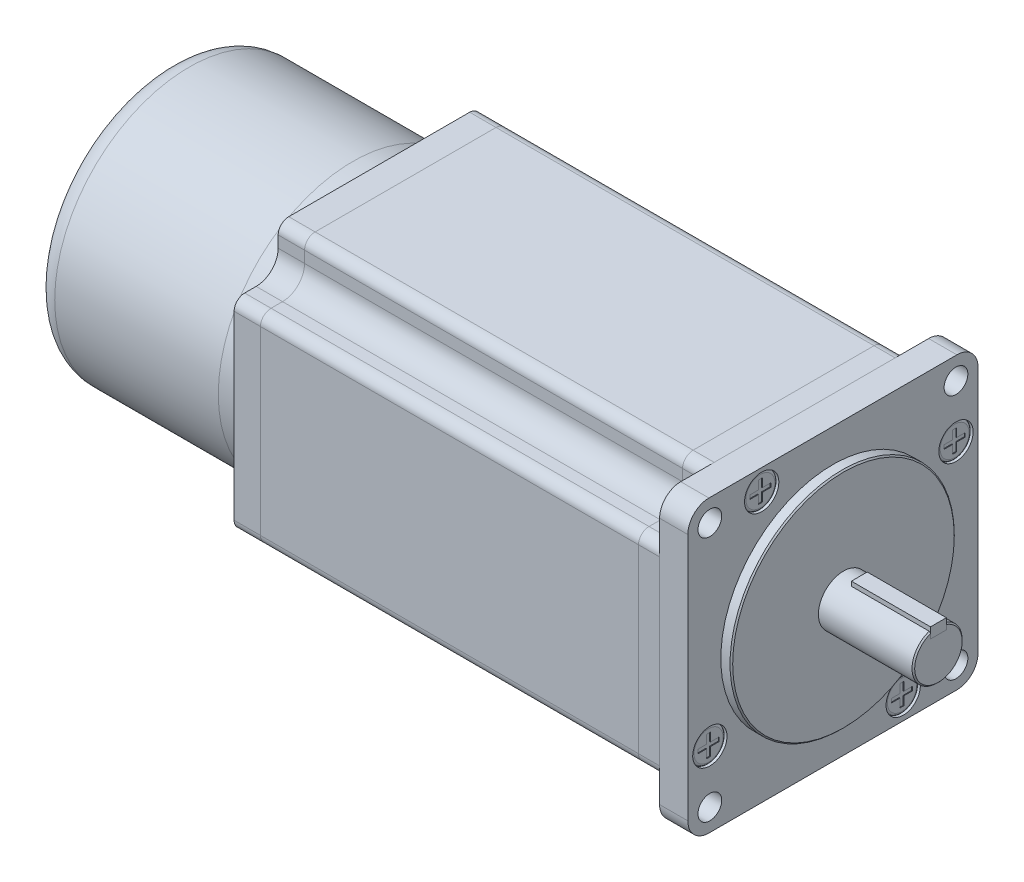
SolidWorks part; units mm, degrees
ref_plane "前视基准面" through (0, 0, 0) normal (0, 0, 1) x (1, 0, 0)
ref_plane "上视基准面" through (0, 0, 0) normal (0, 1, 0) x (1, 0, 0)
ref_plane "右视基准面" through (0, 0, 0) normal (1, 0, 0) x (0, 0, -1)
sketch "草图1" plane through (0, 0, 0) normal (1, 0, 0) x (0, 0, -1)
  line L1 (-47, -55) -> (47, -55)
  line L2 (-55, -47) -> (-55, 47)
  line L3 (-47, 55) -> (47, 55)
  line L4 (55, -47) -> (55, 47)
  line L5 (-55, -55) -> (55, 55) construction
  line L6 (-55, 55) -> (55, -55) construction
  arc A0 (-55, -47) -> (-47, -55) centre (-47, -47) ccw
  arc A1 (47, -55) -> (55, -47) centre (47, -47) ccw
  arc A2 (55, 47) -> (47, 55) centre (47, 47) ccw
  arc A3 (-55, 47) -> (-47, 55) centre (-47, 47) cw
  point P0 (0, 0)
  dimension "D1" = 8
extrude "凸台-拉伸1" add sketch "草图1" against normal blind 10.7
sketch "草图2" plane through (-10.7, 0, 0) normal (-1, 0, 0) x (0, 0, 1)
  line L0 (-55, -47) -> (-55, 47) construction
  line L1 (47, -55) -> (-47, -55)
  line L2 (55, -47) -> (55, 47)
  line L3 (47, 55) -> (-47, 55)
  line L4 (-55, -47) -> (-55, 47)
  line L5 (55, -55) -> (-55, 55) construction
  line L6 (55, 55) -> (-55, -55) construction
  arc A0 (47, -55) -> (55, -47) centre (47, -47) ccw
  arc A1 (55, 47) -> (47, 55) centre (47, 47) ccw
  arc A2 (-47, 55) -> (-55, 47) centre (-47, 47) ccw
  arc A3 (-47, -55) -> (-55, -47) centre (-47, -47) cw
  point P0 (0, 0)
  dimension "D1" = 8
extrude "凸台-拉伸2" add sketch "草图2" along normal blind 8 separate body
sketch "草图3" plane through (-18.7, 0, 0) normal (-1, 0, 0) x (0, 0, 1)
  line L0 (-55, 47) -> (-55, -47) construction
  line L1 (47, -55) -> (-47, -55)
  line L2 (55, -47) -> (55, 47)
  line L3 (47, 55) -> (-47, 55)
  line L4 (-55, -47) -> (-55, 47)
  line L5 (55, -55) -> (-55, 55) construction
  line L6 (55, 55) -> (-55, -55) construction
  arc A0 (47, -55) -> (55, -47) centre (47, -47) ccw
  arc A1 (55, 47) -> (47, 55) centre (47, 47) ccw
  arc A2 (-47, 55) -> (-55, 47) centre (-47, 47) ccw
  arc A3 (-47, -55) -> (-55, -47) centre (-47, -47) cw
  point P0 (0, 0)
  dimension "D1" = 8
extrude "凸台-拉伸3" add sketch "草图3" along normal blind 143.3 separate body
sketch "草图4" plane through (-162, 0, 0) normal (-1, 0, 0) x (0, 0, 1)
  line L0 (-46.65, -38.3) -> (-51, -38.3)
  line L1 (46.65, -38.3) -> (51, -38.3)
  line L2 (-47, -55) -> (-34.3, -55)
  line L3 (38.3, -46.65) -> (38.3, -51)
  line L5 (-55, -47) -> (-55, -34.3)
  line L6 (-55, 34.2927) -> (-55, 47)
  line L9 (-38.3, -46.65) -> (-38.3, -51)
  line L11 (-47, 55) -> (-34.2927, 55)
  line L12 (34.2927, 55) -> (47, 55)
  line L14 (55, 47) -> (55, 34.2927)
  line L15 (55, -34.3) -> (55, -47)
  line L17 (46.65, 38.2927) -> (51, 38.2927)
  line L19 (47, -55) -> (34.3, -55)
  line L20 (38.2927, 46.65) -> (38.2927, 51)
  line L23 (-38.2927, 46.65) -> (-38.2927, 51)
  line L25 (-46.65, 38.2927) -> (-51, 38.2927)
  arc A0 (-38.3, -46.65) -> (-46.65, -38.3) centre (-46.65, -46.65) ccw
  arc A1 (-46.65, 38.2927) -> (-38.2927, 46.65) centre (-46.65, 46.65) ccw
  arc A2 (38.2927, 46.65) -> (46.65, 38.2927) centre (46.65, 46.65) ccw
  arc A3 (46.65, -38.3) -> (38.3, -46.65) centre (46.65, -46.65) ccw
  arc A4 (-55, -47) -> (-47, -55) centre (-47, -47) ccw
  arc A5 (-47, 55) -> (-55, 47) centre (-47, 47) ccw
  arc A6 (55, 47) -> (47, 55) centre (47, 47) ccw
  arc A7 (47, -55) -> (55, -47) centre (47, -47) ccw
  arc A8 (38.3, -51) -> (34.3, -55) centre (34.3, -51) cw
  arc A9 (51, -38.3) -> (55, -34.3) centre (51, -34.3) ccw
  arc A10 (55, 34.2927) -> (51, 38.2927) centre (51, 34.2927) ccw
  arc A11 (38.2927, 51) -> (34.2927, 55) centre (34.2927, 51) ccw
  arc A12 (-34.2927, 55) -> (-38.2927, 51) centre (-34.2927, 51) ccw
  arc A13 (-51, 38.2927) -> (-55, 34.2927) centre (-51, 34.2927) ccw
  arc A14 (-51, -38.3) -> (-55, -34.3) centre (-51, -34.3) cw
  arc A15 (-34.3, -55) -> (-38.3, -51) centre (-34.3, -51) cw
  point P0 (0, 0)
  dimension "D1" = 4
  dimension "D2" = 4
extrude "切除-拉伸1" cut sketch "草图4" against normal blind 161.3
sketch "草图6" plane through (0, 0, 0) normal (1, 0, 0) x (0, 0, -1)
  circle A0 centre (0, 0) radius 42.5
extrude "凸台-拉伸5" add sketch "草图6" along normal blind 4
chamfer "倒角1" distance 0.5 angle 45 1 edges at (4, 0, -42.5)
sketch "草图7" plane through (4, 0, 0) normal (1, 0, 0) x (0, 0, -1)
  circle A0 centre (0, 0) radius 9.5
extrude "凸台-拉伸6" add sketch "草图7" along normal blind 36
chamfer "倒角2" distance 0.5 angle 45 1 edges at (40, 0, -9.5)
sketch "草图8" plane through (40, 0, 0) normal (1, 0, 0) x (0, 0, -1)
  line L3 (-3, 6.7) -> (-3, 9.0139)
  line L5 (3, 9.0139) -> (3, 6.7)
  line L6 (-3, 6.7) -> (3, 6.7)
  arc A0 (3, 9.0139) -> (-3, 9.0139) centre (0, 0) ccw
sketch "草图10" plane through (0, 0, 0) normal (1, 0, 0) x (0, 0, -1)
  line L1 (-46.65, -46.65) -> (46.65, -46.65)
  line L2 (-46.65, -46.65) -> (-46.65, 46.65)
  line L3 (-46.65, 46.65) -> (46.65, 46.65)
  line L4 (46.65, -46.65) -> (46.65, 46.65)
  line L5 (-46.65, -46.65) -> (46.65, 46.65) construction
  line L6 (-46.65, 46.65) -> (46.65, -46.65) construction
  circle A0 centre (46.65, 46.65) radius 4.5
  circle A1 centre (46.65, -46.65) radius 4.5
  circle A2 centre (-46.65, -46.65) radius 4.5
  circle A3 centre (-46.65, 46.65) radius 4.5
  point P0 (0, 0)
extrude "切除-拉伸3" cut sketch "草图10" against normal blind 10.7 contours L3 A3 L2 | L2 A3 L3 | L4 A0 L3 | L3 A0 L4 | L1 A1 L4 | L4 A1 L1 | L2 A2 L1 | L1 A2 L2
sketch "草图11" plane through (0, 0, 0) normal (1, 0, 0) x (0, 0, -1)
  circle A0 centre (-27, 47) radius 6.5
  circle A1 centre (46.65, 26.65) radius 6.5
  circle A2 centre (26.65, -46.65) radius 6.5
  circle A3 centre (-46.65, -26.65) radius 6.5
extrude "切除-拉伸4" cut sketch "草图11" against normal blind 1.5
sketch "草图12" plane through (-1.5, 0, 0) normal (1, 0, 0) x (0, 0, -1)
  circle A0 centre (-27, 47) radius 6.5
  circle A1 centre (46.65, 26.65) radius 6.5
  circle A2 centre (26.65, -46.65) radius 6.5
  circle A3 centre (-46.65, -26.65) radius 6.5
extrude "凸台-拉伸8" add sketch "草图12" along normal blind 1 separate body
fillet "圆角2" radius 1 1 edges at (-0.5, 47, 20.5)
fillet "圆角3" radius 1 1 edges at (-0.5, 26.65, -53.15)
fillet "圆角4" radius 1 1 edges at (-0.5, -26.65, 40.15)
fillet "圆角5" radius 1 1 edges at (-0.5, -46.65, -33.15)
sketch "草图13" plane through (-0.5, 0, 0) normal (1, 0, 0) x (0, 0, -1)
  line L0 (45.9, 25.9) -> (45.9, 22.65)
  line L1 (-27.75, 51) -> (-26.25, 51)
  line L2 (-27.75, 51) -> (-27.75, 47.75)
  line L3 (-27.75, 43) -> (-26.25, 43)
  line L4 (-26.25, 51) -> (-26.25, 47.75)
  line L5 (-47.4, -27.4) -> (-47.4, -30.65)
  line L6 (-47.4, -27.4) -> (-50.65, -27.4)
  line L7 (-23, 47.75) -> (-26.25, 47.75)
  line L8 (-23, 47.75) -> (-23, 46.25)
  line L9 (-23, 46.25) -> (-26.25, 46.25)
  line L10 (-31, 47.75) -> (-31, 46.25)
  line L11 (25.9, -45.9) -> (22.65, -45.9)
  line L12 (-47.4, -25.9) -> (-50.65, -25.9)
  line L13 (45.9, 30.65) -> (47.4, 30.65)
  line L14 (45.9, 30.65) -> (45.9, 27.4)
  line L15 (45.9, 22.65) -> (47.4, 22.65)
  line L16 (47.4, 30.65) -> (47.4, 27.4)
  line L17 (-27.75, 46.25) -> (-27.75, 43)
  line L18 (-45.9, -27.4) -> (-45.9, -30.65)
  line L19 (50.65, 27.4) -> (47.4, 27.4)
  line L20 (50.65, 27.4) -> (50.65, 25.9)
  line L21 (50.65, 25.9) -> (47.4, 25.9)
  line L22 (42.65, 27.4) -> (42.65, 25.9)
  line L25 (25.9, -42.65) -> (27.4, -42.65)
  line L26 (25.9, -42.65) -> (25.9, -45.9)
  line L27 (25.9, -50.65) -> (27.4, -50.65)
  line L28 (27.4, -42.65) -> (27.4, -45.9)
  line L31 (30.65, -45.9) -> (27.4, -45.9)
  line L32 (30.65, -45.9) -> (30.65, -47.4)
  line L33 (30.65, -47.4) -> (27.4, -47.4)
  line L34 (22.65, -45.9) -> (22.65, -47.4)
  line L37 (-47.4, -22.65) -> (-45.9, -22.65)
  line L38 (-47.4, -22.65) -> (-47.4, -25.9)
  line L39 (-47.4, -30.65) -> (-45.9, -30.65)
  line L40 (-45.9, -22.65) -> (-45.9, -25.9)
  line L41 (27.4, -47.4) -> (27.4, -50.65)
  line L43 (-42.65, -25.9) -> (-45.9, -25.9)
  line L44 (-42.65, -25.9) -> (-42.65, -27.4)
  line L45 (-42.65, -27.4) -> (-45.9, -27.4)
  line L46 (-50.65, -25.9) -> (-50.65, -27.4)
  line L48 (25.9, -47.4) -> (22.65, -47.4)
  line L49 (25.9, -47.4) -> (25.9, -50.65)
  line L50 (-27.75, 46.25) -> (-31, 46.25)
  line L51 (-26.25, 46.25) -> (-26.25, 43)
  line L52 (-27.75, 47.75) -> (-31, 47.75)
  line L53 (45.9, 25.9) -> (42.65, 25.9)
  line L54 (47.4, 25.9) -> (47.4, 22.65)
  line L55 (45.9, 27.4) -> (42.65, 27.4)
  point P0 (-27, 47)
  point P6 (-27, 47)
  point P11 (46.65, 26.65)
  point P17 (46.65, 26.65)
  point P22 (26.65, -46.65)
  point P28 (26.65, -46.65)
  point P33 (-46.65, -26.65)
  point P39 (-46.65, -26.65)
extrude "切除-拉伸5" cut sketch "草图13" against normal blind 0.3
sketch "草图14" plane through (-162, 0, 0) normal (-1, 0, 0) x (0, 0, 1)
  line L0 (-51, -38.3) -> (-46.3, -38.3073)
  line L1 (-34.3, -55) -> (34.3, -55)
  line L4 (55, -34.3) -> (55, 34.2927)
  line L6 (-55, -34.3) -> (-55, 34.2927)
  line L7 (-38.3, -46.65) -> (-38.3, -51)
  line L8 (-34.3, -55) -> (34.3, -55)
  line L10 (38.3, -51) -> (38.3, -46.65)
  line L12 (46.65, -38.3) -> (51, -38.3)
  line L14 (55, -34.3) -> (55, 34.2927)
  line L16 (51, 38.2927) -> (46.65, 38.2927)
  line L18 (38.2927, 46.65) -> (38.2927, 51)
  line L19 (34.2927, 55) -> (-34.2927, 55)
  line L21 (-38.2927, 51) -> (-38.2927, 46.65)
  line L23 (-46.65, 38.2927) -> (-51, 38.2927)
  line L25 (-34.2927, 55) -> (34.2927, 55)
  line L27 (55, 46.3) -> (55, 47)
  arc A0 (-38.3, -46.65) -> (-46.9739, -38.3063) centre (-46.65, -46.65) ccw
  arc A2 (38.2927, 46.65) -> (46.65, 38.2927) centre (46.65, 46.65) ccw
  arc A3 (46.65, -38.3) -> (38.3, -46.65) centre (46.65, -46.65) ccw
  arc A4 (34.3, -55) -> (38.3, -51) centre (34.3, -51) ccw
  arc A5 (51, -38.3) -> (55, -34.3) centre (51, -34.3) ccw
  arc A6 (55, 34.2927) -> (51, 38.2927) centre (51, 34.2927) ccw
  arc A7 (38.2927, 51) -> (34.2927, 55) centre (34.2927, 51) ccw
  arc A8 (-34.2927, 55) -> (-38.2927, 51) centre (-34.2927, 51) ccw
  arc A9 (-51, 38.2927) -> (-55, 34.2927) centre (-51, 34.2927) ccw
  arc A10 (-55, -34.3) -> (-51, -38.3) centre (-51, -34.3) ccw
  arc A11 (-38.3, -51) -> (-34.3, -55) centre (-34.3, -51) ccw
  arc A12 (38.2927, 51) -> (34.2927, 55) centre (34.2927, 51) ccw
  arc A13 (-46.65, 38.2927) -> (-38.2927, 46.65) centre (-46.65, 46.65) ccw
  arc A16 (55, 46.3) -> (55, 47) centre (46.65, 46.65) ccw
  point P0 (0, 0)
extrude "凸台-拉伸10" add sketch "草图14" along normal blind 10 separate body
sketch "草图15" plane through (-172, 0, 0) normal (-1, 0, 0) x (0, 0, 1)
  circle A0 centre (0, 0) radius 51
extrude "凸台-拉伸11" add sketch "草图15" along normal blind 10
extrude "切除-拉伸6" cut sketch "草图8" against normal blind 30
sketch "草图16" plane through (0, 6.7, 0) normal (0, 1, 0) x (1, 0, 0)
  line L0 (40, -3) -> (40, 3)
  line L1 (40, 3) -> (10, 3)
  line L2 (10, 3) -> (10, -3)
  line L3 (10, -3) -> (40, -3)
extrude "凸台-拉伸12" add sketch "草图16" along normal blind 4 separate body
sketch "草图17" plane through (-182, 0, 0) normal (-1, 0, 0) x (0, 0, 1)
  circle A0 centre (0, 0) radius 51
extrude "凸台-拉伸13" add sketch "草图17" along normal blind 70 separate body
fillet "圆角6" radius 8 1 edges at (-252, 0, 51)
